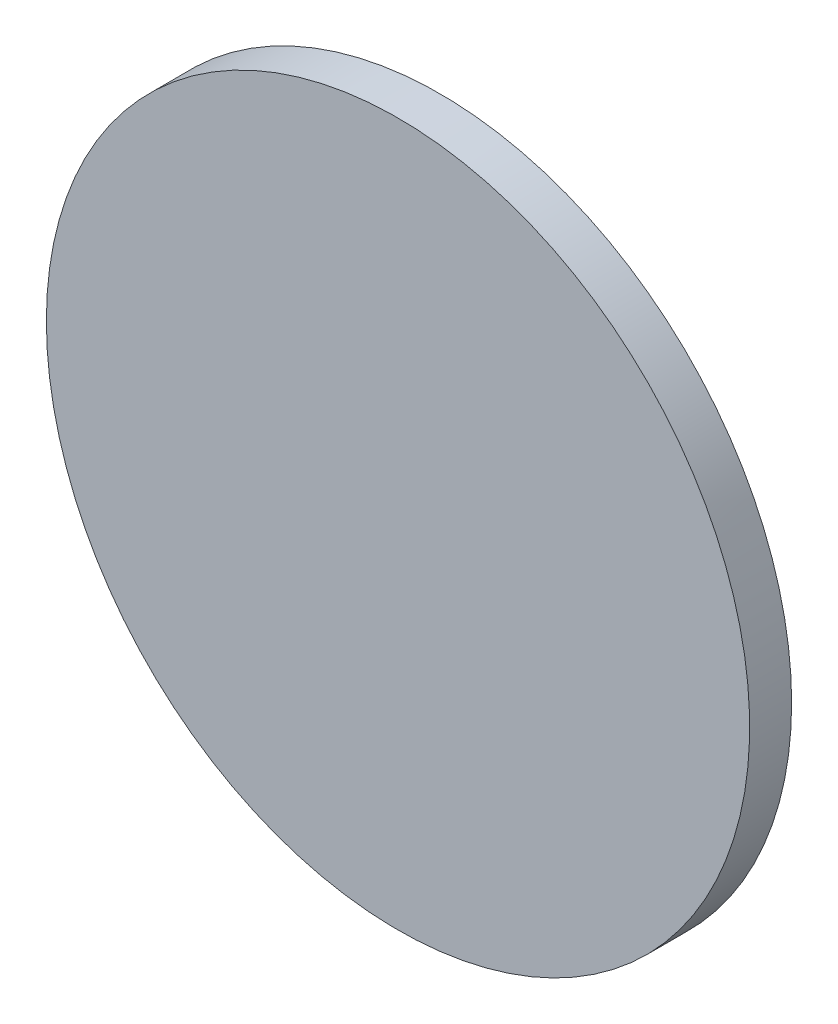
SolidWorks part; units mm, degrees
ref_plane "Front Plane" through (0, 0, 0) normal (0, 0, 1) x (1, 0, 0)
ref_plane "Top Plane" through (0, 0, 0) normal (0, 1, 0) x (1, 0, 0)
ref_plane "Right Plane" through (0, 0, 0) normal (1, 0, 0) x (0, 0, -1)
sketch "Sketch2" plane through (0, 0, 0) normal (0, 1, 0) x (1, 0, 0)
  line L0 (0, 0) -> (0, 9.7) construction
  line L1 (0, 0) -> (-25.4, 0)
  line L2 (-25.4, 0) -> (-25.4, 25) construction
  line L3 (0, 0) -> (0, -42) construction
  line L4 (-25.4, 3) -> (-25.4, 0)
  line L5 (0, 0) -> (0, 9.7)
  line L6 (-25.4, 3) -> (-25.4, 3.0303)
  line L7 (-25.4, 3) -> (-20.7201, 5.7019) construction
  arc A0 (0, 9.7) -> (-25.4, 3.0303) centre (0, -42) ccw
revolve "Revolve1" add sketch "Sketch2" angle 360 about L3
sketch "Sketch3" plane through (0, 0, 0) normal (0, 0, 1) x (1, 0, 0)
  point P0 (0, 0)
equation "\"D4@Sketch2\"=51.7-\"D2@Sketch2\""
